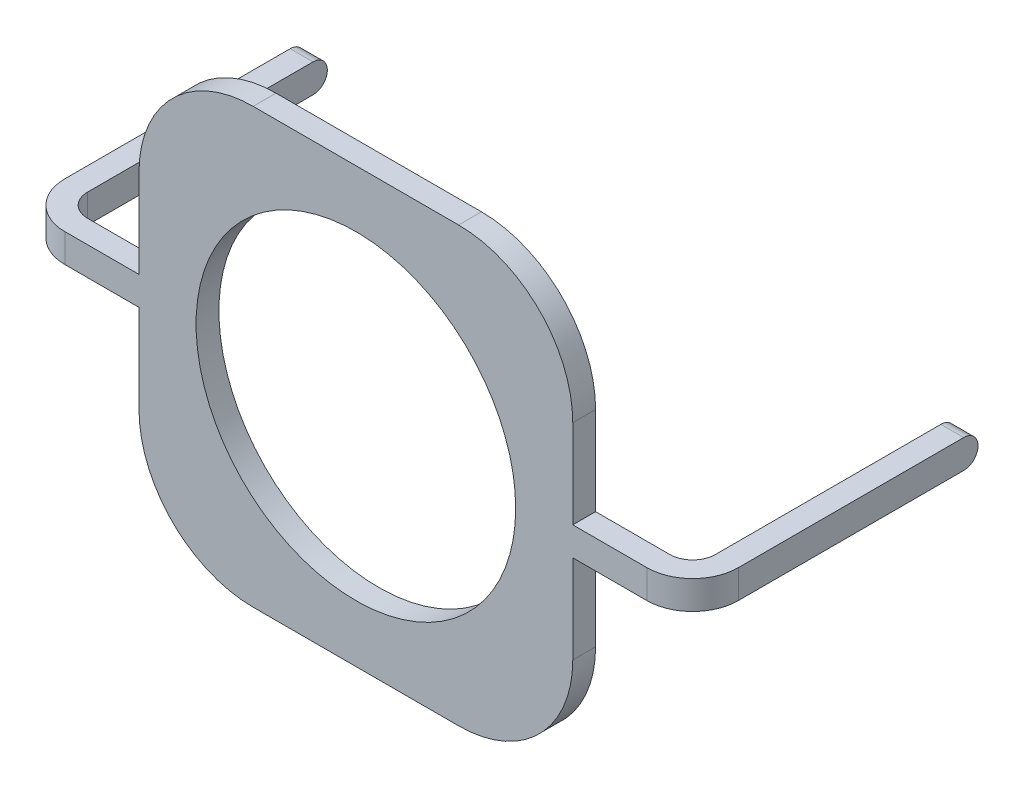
SolidWorks part; units mm, degrees
ref_plane "Face" through (0, 0, 0) normal (0, 0, 1) x (1, 0, 0)
ref_plane "Dessus" through (0, 0, 0) normal (0, 1, 0) x (1, 0, 0)
ref_plane "Droite" through (0, 0, 0) normal (1, 0, 0) x (0, 0, -1)
sketch "Esquisse1" plane through (0, 0, 0) normal (0, 0, 1) x (1, 0, 0)
  line L0 (-38, 17.75) -> (-38, 10)
  line L1 (-28, 38) -> (-10, 38)
  line L2 (-38, 28) -> (-38, 20.25)
  line L3 (-28, 0) -> (-10, 0)
  line L4 (0, 28) -> (0, 20.25)
  line L5 (0, 20.25) -> (8.5, 20.25)
  line L7 (0, 17.75) -> (8.5, 17.75)
  line L8 (8.5, 20.25) -> (8.5, 17.75)
  line L9 (-38, 20.25) -> (-46.5, 20.25)
  line L10 (0, 17.75) -> (0, 10)
  line L11 (-38, 17.75) -> (-46.5, 17.75)
  line L12 (-46.5, 20.25) -> (-46.5, 17.75)
  arc A0 (0, 28) -> (-10, 38) centre (-10, 28) ccw
  arc A1 (0, 10) -> (-10, 0) centre (-10, 10) cw
  arc A2 (-38, 10) -> (-28, 0) centre (-28, 10) ccw
  arc A3 (-28, 38) -> (-38, 28) centre (-28, 28) ccw
  circle A4 centre (-19, 19) radius 14
  point P8 (0, 0)
  point P11 (-38, 0)
  point P14 (-38, 38)
  dimension "D1" = 10
  dimension "D4" = 10
  dimension "D5" = 28
  dimension "D6" = 19
  dimension "D7" = 19
  dimension "D2" = 38
  dimension "D3" = 38
  dimension "D8" = 2.5
  dimension "D9" = 2.5
  dimension "D10" = 17.75
  dimension "D11" = 17.75
  dimension "D12" = 8.5
  dimension "D13" = 8.5
extrude "Base-Extrusion" add sketch "Esquisse1" along normal blind 2
sketch "Esquisse3" plane through (8.5, 0, 0) normal (1, 0, 0) x (0, 0, -1)
  line L0 (-2, 20.25) -> (0, 20.25) construction
  line L1 (-2, 17.75) -> (23, 17.75)
  line L2 (-2, 17.75) -> (-2, 20.25)
  line L3 (-2, 20.25) -> (23, 20.25)
  line L4 (23, 17.75) -> (23, 20.25)
  dimension "D1" = 25
extrude "Boss.-Extru.1" add sketch "Esquisse3" along normal blind 2
sketch "Esquisse4" plane through (-46.5, 0, 0) normal (-1, 0, 0) x (0, 0, 1)
  line L0 (2, 20.25) -> (0, 20.25) construction
  line L1 (2, 20.25) -> (2, 17.75) construction
  line L2 (2, 17.75) -> (0, 17.75) construction
  line L3 (0, 17.75) -> (-23, 17.75) construction
  line L4 (-23, 17.75) -> (-23, 20.25) construction
  line L5 (-23, 20.25) -> (0, 20.25) construction
  line L6 (2, 20.25) -> (0, 20.25)
  line L7 (2, 20.25) -> (2, 17.75)
  line L8 (2, 17.75) -> (0, 17.75)
  line L9 (0, 17.75) -> (-23, 17.75)
  line L10 (-23, 17.75) -> (-23, 20.25)
  line L11 (-23, 20.25) -> (0, 20.25)
extrude "Boss.-Extru.2" add sketch "Esquisse4" along normal blind 2
fillet "Congé1" radius 4
fillet "Congé2" radius 2
fillet "Congé3" radius 1.25
ref_plane "Plan1" through (-45.5, 0, 0) normal (-1, 0, 0) x (0, 0, 1)
sketch "Esquisse5" plane through (-45.5, 0, 0) normal (-1, 0, 0) x (0, 0, 1)
  line L0 (0, 20.25) -> (0, 17.75) construction
  line L1 (2, 20.25) -> (-2, 20.25) construction
  line L3 (0, 17.75) -> (0, 20.25) construction
  point P0 (0.5, 19)
  dimension "D1" = 1.25
  dimension "D2" = 0.5
ref_plane "Plan2" through (7.5, 0, 0) normal (1, 0, 0) x (0, 0, -1)
sketch "Esquisse6" plane through (7.5, 0, 0) normal (1, 0, 0) x (0, 0, -1)
  point P0 (-0.5, 19)
